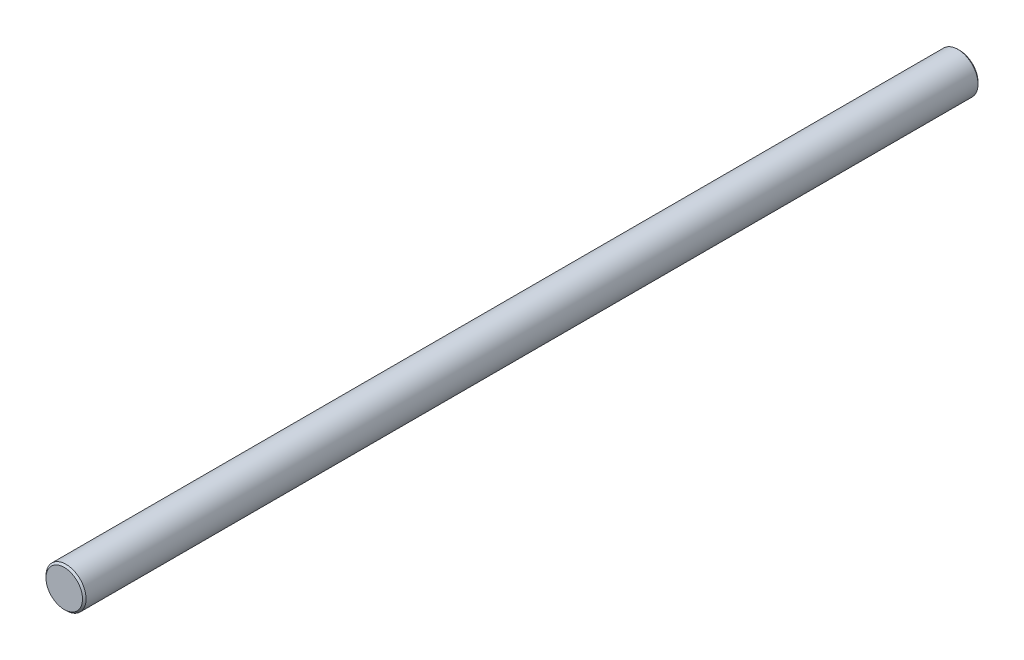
SolidWorks part; units mm, degrees
ref_plane "Plane1" through (0, 0, 0) normal (0, 0, 1) x (1, 0, 0)
ref_plane "Plane2" through (0, 0, 0) normal (0, 1, 0) x (1, 0, 0)
ref_plane "Plane3" through (0, 0, 0) normal (1, 0, 0) x (0, 0, -1)
sketch "Sketch1" plane through (0, 0, 0) normal (0, 0, 1) x (1, 0, 0)
  circle A0 centre (0, 0) radius 1.4224
  dimension "D1" = 2.8448
extrude "Base-Extrude" add sketch "Sketch1" along normal blind 63.5
chamfer "Chamfer1" distance 0.127 angle 45
